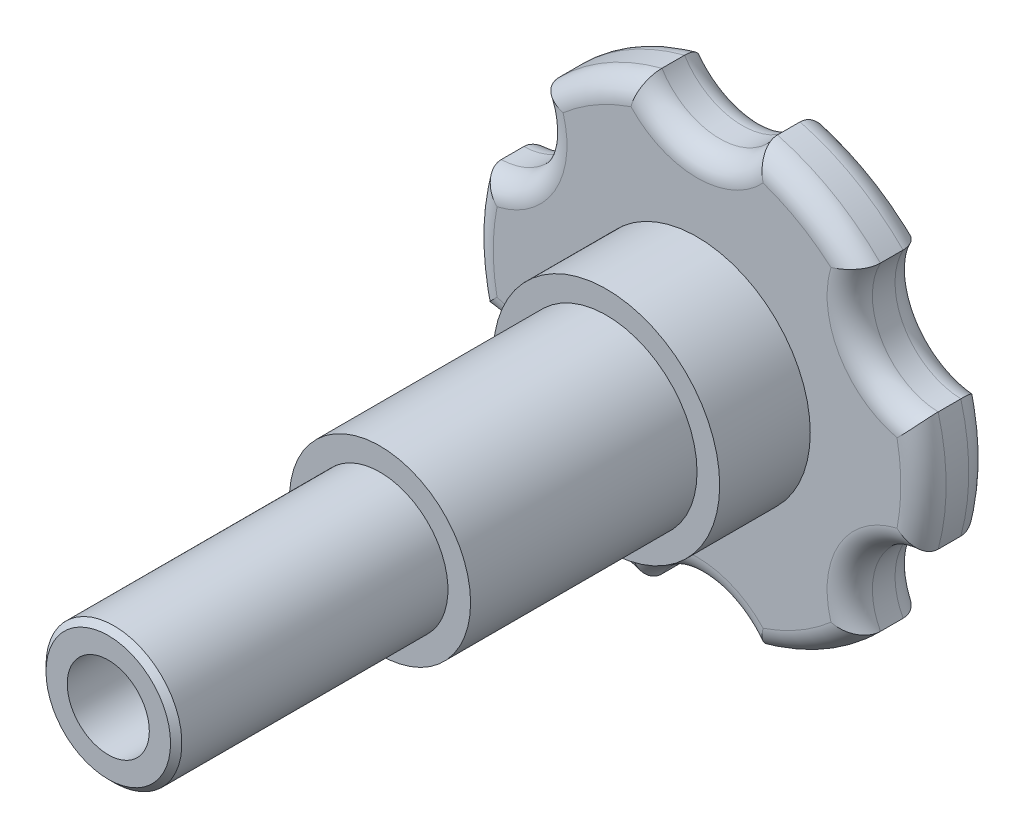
SolidWorks part; units mm, degrees
ref_plane "Plane1" through (0, 0, 0) normal (0, 0, 1) x (1, 0, 0)
ref_plane "Plane2" through (0, 0, 0) normal (0, 1, 0) x (1, 0, 0)
ref_plane "Plane3" through (0, 0, 0) normal (1, 0, 0) x (0, 0, -1)
sketch "Sketch1" plane through (0, 0, 0) normal (0, 0, 1) x (1, 0, 0)
  circle A0 centre (0, 0) radius 31.75
  dimension "D1" = 63.5
extrude "Base-Extrude" add sketch "Sketch1" along normal blind 9.525
sketch "Sketch2" plane through (0, 0, 0) normal (0, 0, 1) x (1, 0, 0)
  line L0 (0, 41.3652) -> (0, -9.4348) construction
  line L1 (-25.4, 0) -> (25.4, 0) construction
  circle A0 centre (0, 35.7188) radius 9.525
  dimension "D1" = 19.05
  dimension "D2" = 35.7188
extrude "Cut-Extrude2" cut sketch "Sketch2" along normal through all
pattern_circular "CirPattern1" count 6 every 60 about axis through (0, 0, 0) along (0, 0, 1) of "Cut-Extrude2"
fillet "Fillet1" radius 3.175 12 edges at (15.875, 27.4963, 9.525) (22.6845, 13.0969, 9.525) (31.75, 0, 9.525) (22.6845, -13.0969, 9.525) (15.875, -27.4963, 9.525) (0, -26.1938, 9.525) (-15.875, -27.4963, 9.525) (-22.6845, -13.0969, 9.525) (-31.75, 0, 9.525) (-22.6845, 13.0969, 9.525) (-15.875, 27.4963, 9.525) (0, 26.1938, 9.525)
fillet "Fillet2" radius 3.175 12 edges at (15.875, 27.4963, 0) (22.6845, 13.0969, 0) (31.75, 0, 0) (22.6845, -13.0969, 0) (15.875, -27.4963, 0) (0, -26.1938, 0) (-15.875, -27.4963, 0) (-22.6845, -13.0969, 0) (-31.75, 0, 0) (-15.875, 27.4963, 0) (-22.6845, 13.0969, 0) (0, 26.1938, 0)
sketch "Sketch4" plane through (0, 0, 9.525) normal (0, 0, 1) x (1, 0, 0)
  circle A0 centre (0, 0) radius 15.875
  dimension "D1" = 31.75
extrude "Boss-Extrude1" add sketch "Sketch4" along normal blind 12.7
sketch "Sketch5" plane through (0, 0, 22.225) normal (0, 0, 1) x (1, 0, 0)
  circle A0 centre (0, 0) radius 12.7
  dimension "D1" = 25.4
extrude "Boss-Extrude2" add sketch "Sketch5" along normal blind 31.75
sketch "Sketch6" plane through (0, 0, 53.975) normal (0, 0, 1) x (1, 0, 0)
  circle A0 centre (0, 0) radius 9.525
  dimension "D1" = 19.05
extrude "Boss-Extrude3" add sketch "Sketch6" along normal blind 38.1
chamfer "Chamfer1" distance 0.7937 angle 45 1 edges at (9.525, 0, 92.075)
sketch "Sketch7" plane through (0, 0, 92.075) normal (0, 0, 1) x (1, 0, 0)
  circle A0 centre (0, 0) radius 5.7544
  dimension "D1" = 11.5087
extrude "Cut-Extrude5" cut sketch "Sketch7" against normal through all
